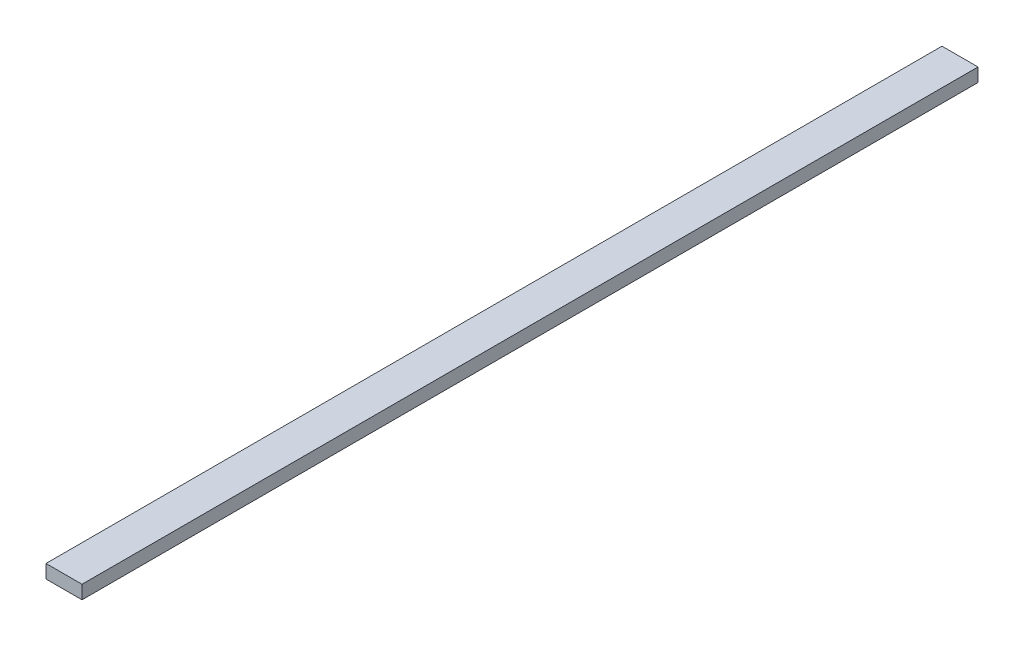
SolidWorks part; units mm, degrees
ref_plane "Plan de face" through (0, 0, 0) normal (0, 0, 1) x (1, 0, 0)
ref_plane "Plan de dessus" through (0, 0, 0) normal (0, 1, 0) x (1, 0, 0)
ref_plane "Plan de droite" through (0, 0, 0) normal (1, 0, 0) x (0, 0, -1)
sketch "Esquisse1" plane through (0, 0, 0) normal (0, 0, 1) x (1, 0, 0)
  line L1 (-20, 7.5) -> (20, 7.5)
  line L2 (-20, 7.5) -> (-20, -7.5)
  line L3 (-20, -7.5) -> (20, -7.5)
  line L4 (20, 7.5) -> (20, -7.5)
  dimension "D1" = 40
  dimension "D2" = 15
  dimension "D3" = 20
  dimension "D4" = 7.5
extrude "Extrusion1" add sketch "Esquisse1" along normal blind 995
